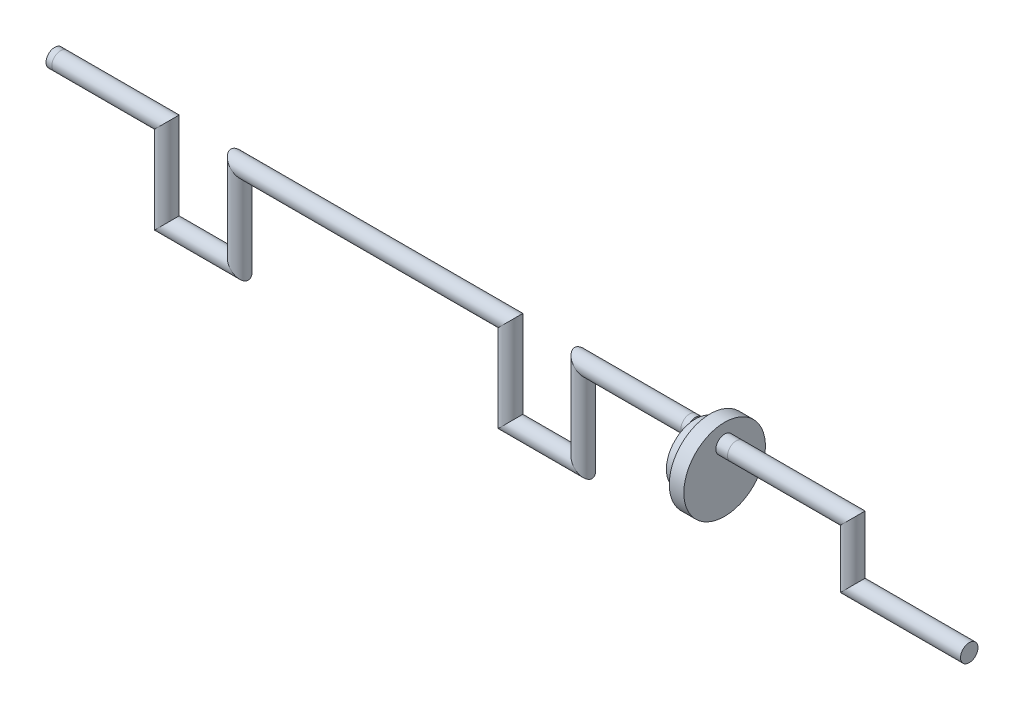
SolidWorks part; units mm, degrees
ref_plane "Front Plane" through (0, 0, 0) normal (0, 0, 1) x (1, 0, 0)
ref_plane "Top Plane" through (0, 0, 0) normal (0, 1, 0) x (1, 0, 0)
ref_plane "Right Plane" through (0, 0, 0) normal (1, 0, 0) x (0, 0, -1)
sketch "Sketch2" plane through (0, 0, 0) normal (0, 0, 1) x (1, 0, 0)
  line L0 (0, 0) -> (40, 0)
  line L1 (40, 0) -> (40, -20)
  line L2 (40, -20) -> (80, -20)
  line L3 (0, 0) -> (-4, 0)
  dimension "D1" = 40
  dimension "D2" = 40
  dimension "D3" = 20
  dimension "D4" = 4
ref_plane "Plane1" through (80, 0, 0) normal (1, 0, 0) x (0, 0, -1)
sketch "Sketch3" plane through (80, 0, 0) normal (1, 0, 0) x (0, 0, -1)
  circle A0 centre (0, -20) radius 3
  dimension "D1" = 6
sweep "Sweep1" add profiles "Sketch3" path "Sketch2"
sketch "Sketch4" plane through (-4, 0, 0) normal (-1, 0, 0) x (0, 0, 1)
  line L0 (0, -7.5) -> (0, 0) construction
  circle A1 centre (0, -7.5) radius 14
  dimension "D1" = 28
  dimension "D2" = 7.5
extrude "Boss-Extrude1" add sketch "Sketch4" along normal blind 5
sketch "Sketch5" plane through (-9, 0, 0) normal (-1, 0, 0) x (0, 0, 1)
  circle A0 centre (0, -7.5) radius 10
  dimension "D1" = 20
extrude "Boss-Extrude2" add sketch "Sketch5" along normal blind 5
sketch "Sketch8" plane through (0, 0, 0) normal (0, 0, 1) x (1, 0, 0)
  line L0 (-14, 0) -> (-16, 0)
  line L1 (-14, 2.5) -> (-14, -17.5) construction
  line L2 (-52.5, 0) -> (-52.5, -30)
  line L3 (-52.5, -30) -> (-77.5, -30)
  line L4 (-77.5, -30) -> (-77.5, 0)
  line L5 (-77.5, 0) -> (-170.5, 0)
  line L6 (-124, 40.9318) -> (-124, 57.6592) construction
  line L7 (-16, 0) -> (-52.5, 0)
  line L8 (-232, 0) -> (-195.5, 0)
  line L9 (-170.5, -30) -> (-170.5, 0)
  line L10 (-195.5, -30) -> (-170.5, -30)
  line L11 (-195.5, 0) -> (-195.5, -30)
  line L12 (-234, 0) -> (-232, 0)
  point P13 (0, 0)
  point P19 (-124, 0)
  point P23 (-214, 0)
  point P24 (-214, 0)
  dimension "D1" = 46.5
  dimension "D2" = 25
  dimension "D3" = 36.5
  dimension "D4" = 2
  dimension "D5" = 30
  dimension "D6" = 2.5
ref_plane "Plane4" through (-234, 0, 0) normal (1, 0, 0) x (0, 0, -1)
sketch "Sketch9" plane through (-234, 0, 0) normal (1, 0, 0) x (0, 0, -1)
  circle A0 centre (0, 0) radius 3
  dimension "D1" = 6
sweep "Sweep2" add profiles "Sketch9" path "Sketch8"
